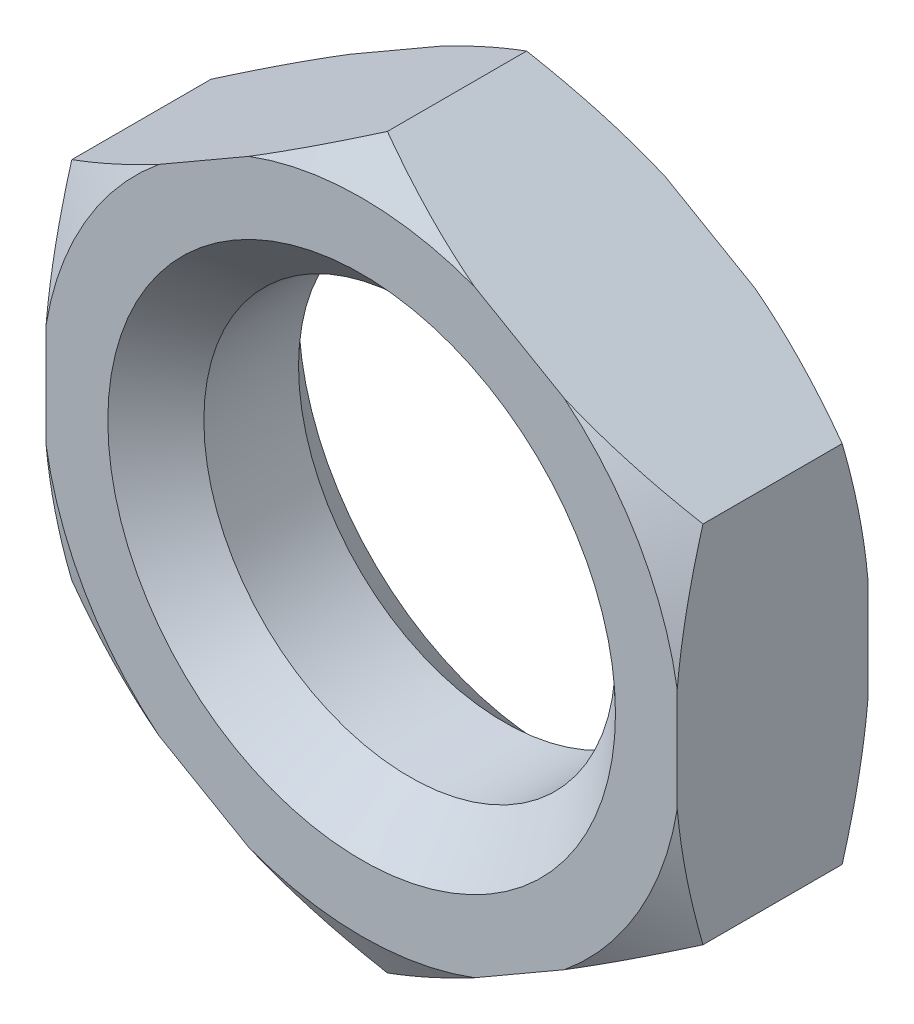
SolidWorks part; units mm, degrees
ref_plane "Front Plane" through (0, 0, 0) normal (0, 0, 1) x (1, 0, 0)
ref_plane "Top Plane" through (0, 0, 0) normal (0, 1, 0) x (1, 0, 0)
ref_plane "Right Plane" through (0, 0, 0) normal (1, 0, 0) x (0, 0, -1)
sketch "Sketch3" plane through (0, 0, 0) normal (0, 0, 1) x (1, 0, 0)
  line L1 (0, 26.5581) -> (-23, 13.2791)
  line L2 (-23, 13.2791) -> (-23, -13.2791)
  line L3 (-23, -13.2791) -> (0, -26.5581)
  line L4 (0, -26.5581) -> (23, -13.2791)
  line L5 (23, -13.2791) -> (23, 13.2791)
  line L6 (23, 13.2791) -> (0, 26.5581)
  circle A0 centre (0, 0) radius 23 construction
  dimension "D1" = 46
extrude "Boss-Extrude1" add sketch "Sketch3" along normal mid plane 13.9
sketch "Sketch4" plane through (0, 0, 0) normal (1, 0, 0) x (0, 0, -1)
  line L0 (-5.4578, 0) -> (6.1545, 0) construction
sketch "Sketch5" plane through (0, 0, 0) normal (1, 0, 0) x (0, 0, -1)
  line L0 (-6.95, 26.5581) -> (-6.95, 23.3081)
  line L1 (-6.95, 13.2791) -> (-6.95, 26.5581) construction
  line L2 (-6.95, 23.3081) -> (-5.0736, 26.5581)
  line L3 (-6.95, 26.5581) -> (6.95, 26.5581) construction
  line L4 (-5.0736, 26.5581) -> (-6.95, 26.5581)
  dimension "D1" = 3.25
  dimension "D2" = 30
revolve "Cut-Revolve1" cut sketch "Sketch5" angle 360 about L0
mirror "Mirror1" about plane through (0, 0, 0) normal (0, 0, 1) of "Cut-Revolve1"
sketch "Sketch6" plane through (0, 0, 6.95) normal (0, 0, 1) x (1, 0, 0)
  circle A0 centre (0, 0) radius 15
  dimension "D1" = 30
extrude "Cut-Extrude1" cut sketch "Sketch6" against normal blind 13.9
chamfer "Chamfer1" distance 3.5 angle 45 2 edges at (15, 0, -6.95) (15, 0, 6.95)
